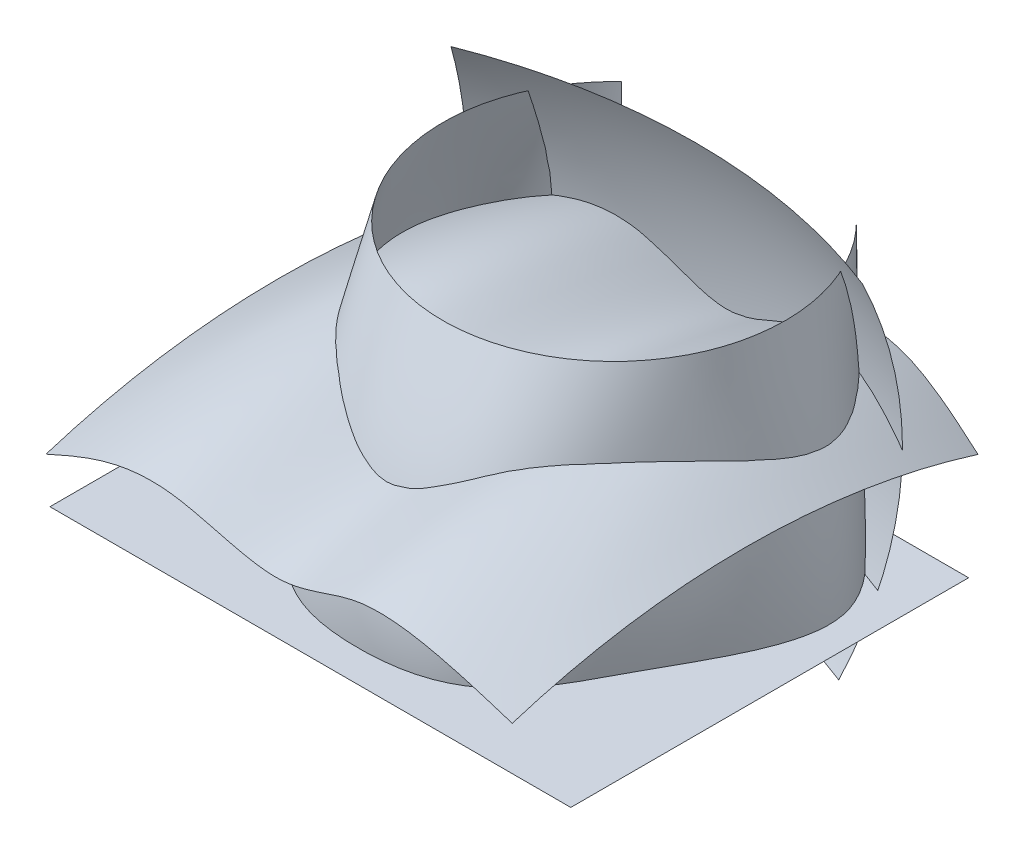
SolidWorks part; units mm, degrees
ref_plane "Front Plane" through (0, 0, 0) normal (0, 0, 1) x (1, 0, 0)
ref_plane "Top Plane" through (0, 0, 0) normal (0, 1, 0) x (1, 0, 0)
ref_plane "Right Plane" through (0, 0, 0) normal (1, 0, 0) x (0, 0, -1)
ref_plane "Plane1" through (0, 74.3904, 0) normal (0, 1, 0) x (-1, 0, 0)
sketch "Sketch1" plane through (0, 0, 0) normal (0, 1, 0) x (1, 0, 0)
  line L0 (0, -55) -> (0, 55) construction
  line L1 (8.1344, -47.455) -> (-25.9496, -47.455) construction
  line L2 (0, 0) -> (0, -66.183) construction
  spline S0 degree 3 poles (-36.1864, 69.9921) (-49.9318, 59.3372) (-78.4656, 37.2188) (-44.376, -15.946) (-32.0402, -47.455) (0, -47.455) knots 0 0 0 0 0.290882 0.603836 1 1 1 1
  spline S1 degree 3 poles (36.1864, 69.9921) (49.9318, 59.3372) (78.4656, 37.2188) (44.376, -15.946) (32.0402, -47.455) (0, -47.455) knots 0 0 0 0 0.290882 0.603836 1 1 1 1
sketch "Sketch2" plane through (0, 74.3904, 0) normal (0, 1, 0) x (-1, 0, 0)
  arc A0 (-36.1864, -69.9921) -> (36.1864, -69.9921) centre (0, -31.4728) cw
surface "Surface-Loft1"
sketch "Sketch3" plane through (0, 0, 0) normal (0, 0, 1) x (1, 0, 0)
  line L0 (0, -40.9147) -> (0, 40.9147) construction
  line L1 (0, 0) -> (0, 93.9781) construction
  line L2 (-109.5463, -199.7213) -> (189.6196, -199.7213) construction
  spline S0 degree 3 poles (-71.8678, 39.0348) (-57.368, 47.2902) (-33.3039, 60.991) (0, 35.7926) (33.3039, 60.991) (57.368, 47.2902) (71.8678, 39.0348) knots 0 0 0 0 0.301274 0.5 0.698726 1 1 1 1
surface "Surface-Revolve1" sketch "Sketch3" parameters "D1"=35, "D2"=180
sketch "Sketch5" plane through (0, 0, 0) normal (1, 0, 0) x (0, 0, -1)
  line L0 (-116.4628, 59.2712) -> (-116.4628, 42.1208) construction
  arc A0 (56.696, 82.7861) -> (51.0126, -21.2452) centre (-51.6684, 36.5354) cw
surface "Surface-Revolve2" sketch "Sketch5" parameters "D1"=43, "D2"=180
sketch "Sketch6" plane through (0, 0, 0) normal (0, 1, 0) x (1, 0, 0)
  line L1 (-85.2057, 65.3977) -> (75.372, 65.3977)
  line L2 (-85.2057, 65.3977) -> (-85.2057, -57.2475)
  line L3 (-85.2057, -57.2475) -> (75.372, -57.2475)
  line L4 (75.372, 65.3977) -> (75.372, -57.2475)
surface "Surface-Plane3" sketch "Sketch6"
